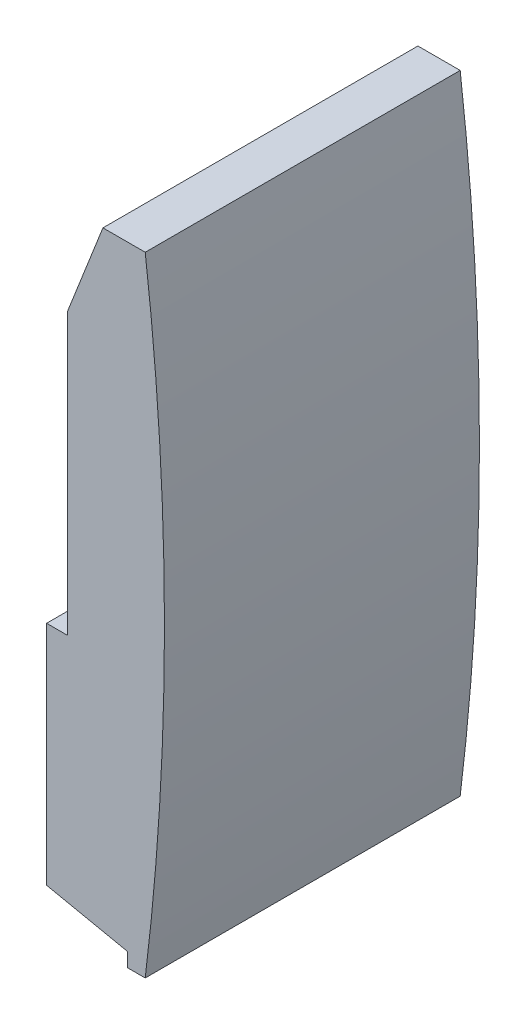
SolidWorks part; units mm, degrees
ref_plane "Plan de face" through (0, 0, 0) normal (0, 0, 1) x (1, 0, 0)
ref_plane "Plan de dessus" through (0, 0, 0) normal (0, 1, 0) x (1, 0, 0)
ref_plane "Plan de droite" through (0, 0, 0) normal (1, 0, 0) x (0, 0, -1)
sketch "Esquisse1" plane through (0, 0, 0) normal (0, 0, 1) x (1, 0, 0)
  line L0 (349, -40.2) -> (360.5, -42.6)
  line L1 (360.5, -42.6) -> (360.5, -44.6)
  line L2 (360.5, -44.6) -> (363, -44.6)
  line L3 (349, -40.2) -> (349, -8)
  line L4 (349, -8) -> (352, -8)
  line L5 (352, -8) -> (352, 31.9)
  line L6 (352, 31.9) -> (357, 44.6)
  line L7 (357, 44.6) -> (363, 44.6)
  line L8 (0, 0) -> (352, 0) construction
  arc A0 (363, 44.6) -> (363, -44.6) centre (0, 0) cw
  dimension "D1" = 2.5
  dimension "D2" = 2
  dimension "D3" = 14
  dimension "D4" = 4.4
  dimension "D5" = 32.2
  dimension "D6" = 3
  dimension "D7" = 8
  dimension "D9" = 6
  dimension "D10" = 12.7
  dimension "D11" = 352
extrude "Boss.-Extru.1" add sketch "Esquisse1" along normal mid plane 44.7
